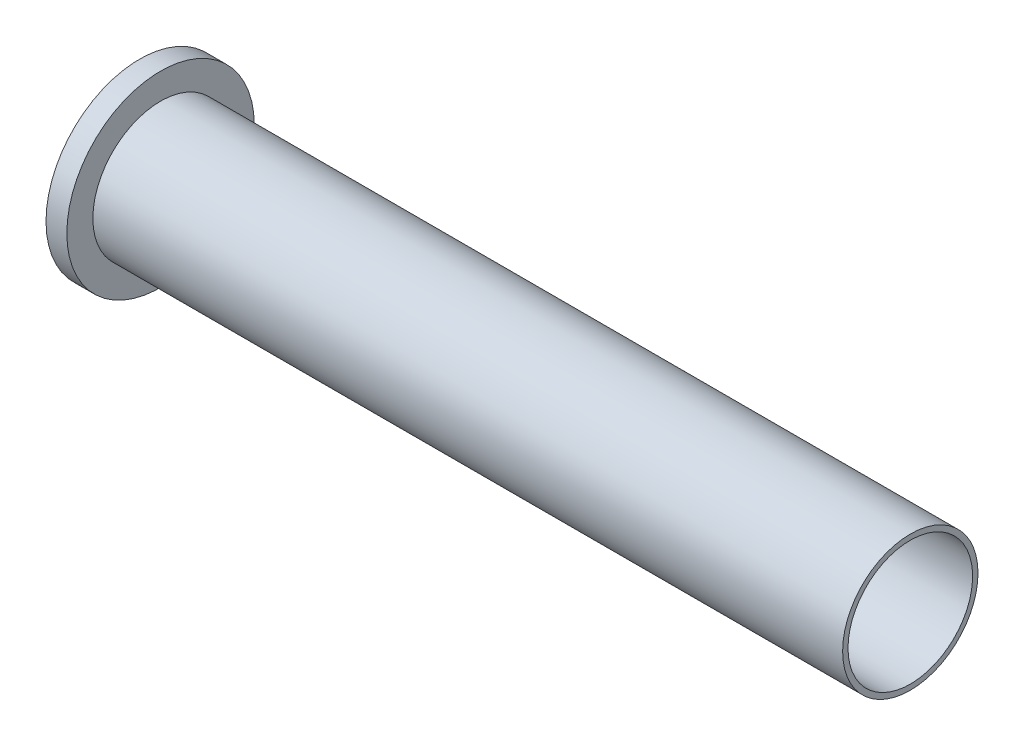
SolidWorks part; units mm, degrees
ref_plane "Front Plane" through (0, 0, 0) normal (0, 0, 1) x (1, 0, 0)
ref_plane "Top Plane" through (0, 0, 0) normal (0, 1, 0) x (1, 0, 0)
ref_plane "Right Plane" through (0, 0, 0) normal (1, 0, 0) x (0, 0, -1)
sketch "Sketch1" plane through (0, 0, 0) normal (1, 0, 0) x (0, 0, -1)
  circle A0 centre (0, 0) radius 20.6375
  dimension "D1" = 41.275
extrude "Extrude1" add sketch "Sketch1" along normal blind 228.6
sketch "Sketch2" plane through (0, 0, 0) normal (-1, 0, 0) x (0, 0, 1)
  circle A0 centre (0, 0) radius 28.575
  dimension "D1" = 57.15
extrude "Extrude2" add sketch "Sketch2" along normal blind 6.35
sketch "Sketch3" plane through (-6.35, 0, 0) normal (-1, 0, 0) x (0, 0, 1)
  circle A0 centre (0, 0) radius 18.9992
  dimension "D1" = 37.9984
extrude "Cut-Extrude1" cut sketch "Sketch3" against normal through all
